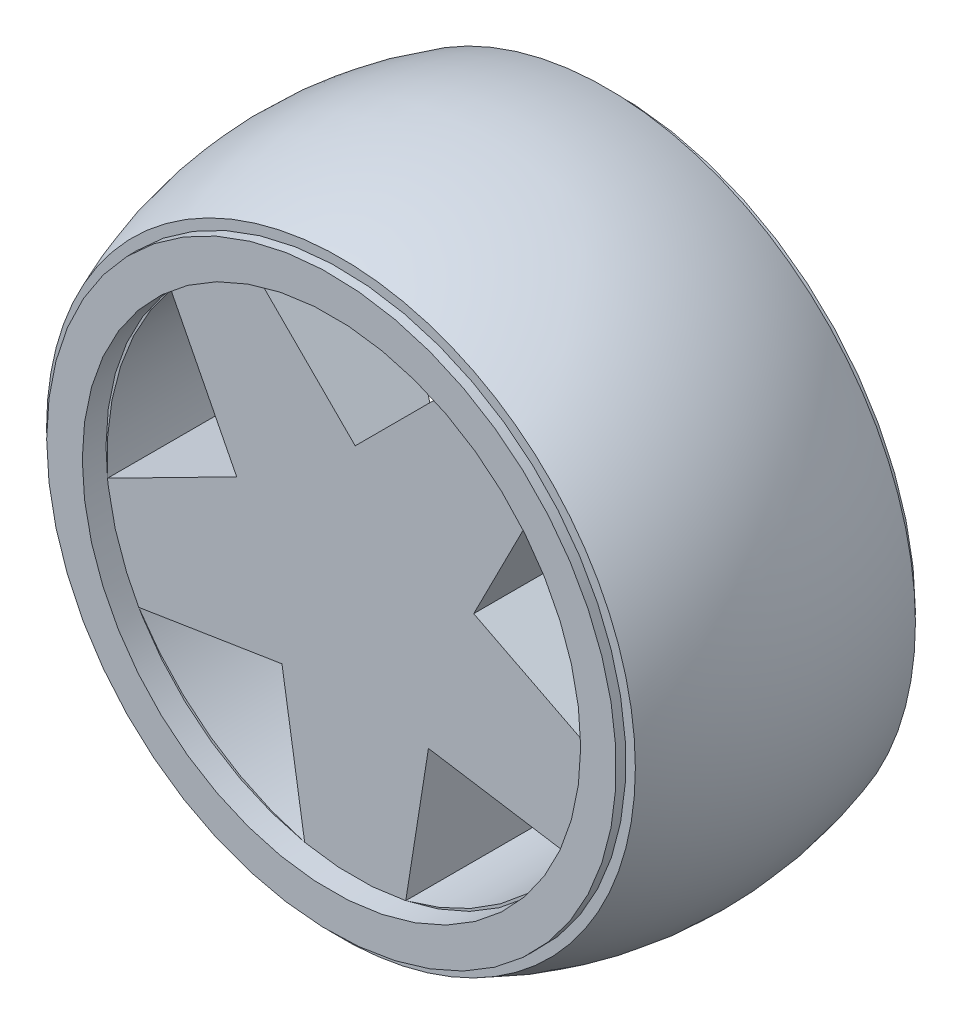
SolidWorks part; units mm, degrees
ref_plane "Alzado" through (0, 0, 0) normal (0, 0, 1) x (1, 0, 0)
ref_plane "Planta" through (0, 0, 0) normal (0, 1, 0) x (1, 0, 0)
ref_plane "Vista lateral" through (0, 0, 0) normal (1, 0, 0) x (0, 0, -1)
sketch "Croquis1" plane through (0, 0, 0) normal (0, 1, 0) x (1, 0, 0)
  line L0 (5.5, 0) -> (0, 0)
  line L1 (0, 0) -> (0, -30) construction
  line L2 (0, -30) -> (30, -30)
  line L3 (30, -30) -> (30.0094, -29)
  line L4 (30.0094, -29) -> (31.0094, -29)
  line L6 (32.5094, -1) -> (31.5094, -1)
  line L7 (31.5094, -1) -> (31.5094, 0)
  line L8 (31.5094, 0) -> (24.5094, 0)
  line L9 (24.5094, 0) -> (24.5094, -13.6119)
  line L10 (24.5094, -13.6119) -> (12.1066, -20.1779)
  line L11 (12.1066, -20.1779) -> (5.9122, -20.1779)
  line L12 (5.9122, -20.1779) -> (5.5, 0)
  line L13 (0, 0) -> (0, -30)
  arc A0 (32.5094, -1) -> (31.0094, -29) centre (-5.5308, -13.0023) cw
  dimension "D1" = 5.5
  dimension "D2" = 30
  dimension "D3" = 30
  dimension "D4" = 1
  dimension "D5" = 7
  dimension "D6" = 6.1944
revolve "Revolución1" add sketch "Croquis1" angle 360 about L1
sketch "Croquis2" plane through (0, 0, 0) normal (0, 0, -1) x (-1, 0, 0)
  circle A0 centre (0, 0) radius 2.5
  dimension "D1" = 5
extrude "Cortar-Extruir1" cut sketch "Croquis2" against normal blind 10
sketch "Croquis3" plane through (0, 0, 30) normal (0, 0, 1) x (1, 0, 0)
  circle A0 centre (0, 0) radius 26.25
  dimension "D1" = 52.5
extrude "Cortar-Extruir2" cut sketch "Croquis3" against normal blind 2.5
sketch "Croquis4" plane through (0, 0, 27.5) normal (0, 0, 1) x (1, 0, 0)
  line L0 (0, 0) -> (0, 26.25) construction
  line L1 (0, 13.125) -> (-10.8002, 23.9252)
  line L2 (0, 13.125) -> (10.8002, 23.9252)
  line L3 (12.4826, 4.0558) -> (19.4168, 17.6649)
  line L4 (12.4826, 4.0558) -> (26.0917, -2.8783)
  line L5 (7.7147, -10.6183) -> (22.8005, -13.0077)
  line L6 (7.7147, -10.6183) -> (5.3253, -25.7042)
  line L7 (-7.7147, -10.6183) -> (-5.3253, -25.7042)
  line L8 (-7.7147, -10.6183) -> (-22.8005, -13.0077)
  line L9 (-12.4826, 4.0558) -> (-26.0917, -2.8783)
  line L10 (-12.4826, 4.0558) -> (-19.4168, 17.6649)
  circle A0 centre (0, 0) radius 26.25 construction
  circle A1 centre (0, 0) radius 26.25 construction
  arc A2 (10.8002, 23.9252) -> (-10.8002, 23.9252) centre (0, -3.3911) ccw
  arc A3 (26.0917, -2.8783) -> (19.4168, 17.6649) centre (-3.2251, -1.0479) ccw
  arc A4 (5.3253, -25.7042) -> (22.8005, -13.0077) centre (-1.9932, 2.7434) ccw
  arc A5 (-22.8005, -13.0077) -> (-5.3253, -25.7042) centre (1.9932, 2.7434) ccw
  arc A6 (-19.4168, 17.6649) -> (-26.0917, -2.8783) centre (3.2251, -1.0479) ccw
  point P30 (0, 0)
  dimension "D1" = 90
  dimension "D2" = 45
  dimension "D3" = 5
extrude "Cortar-Extruir3" cut sketch "Croquis4" against normal blind 28
